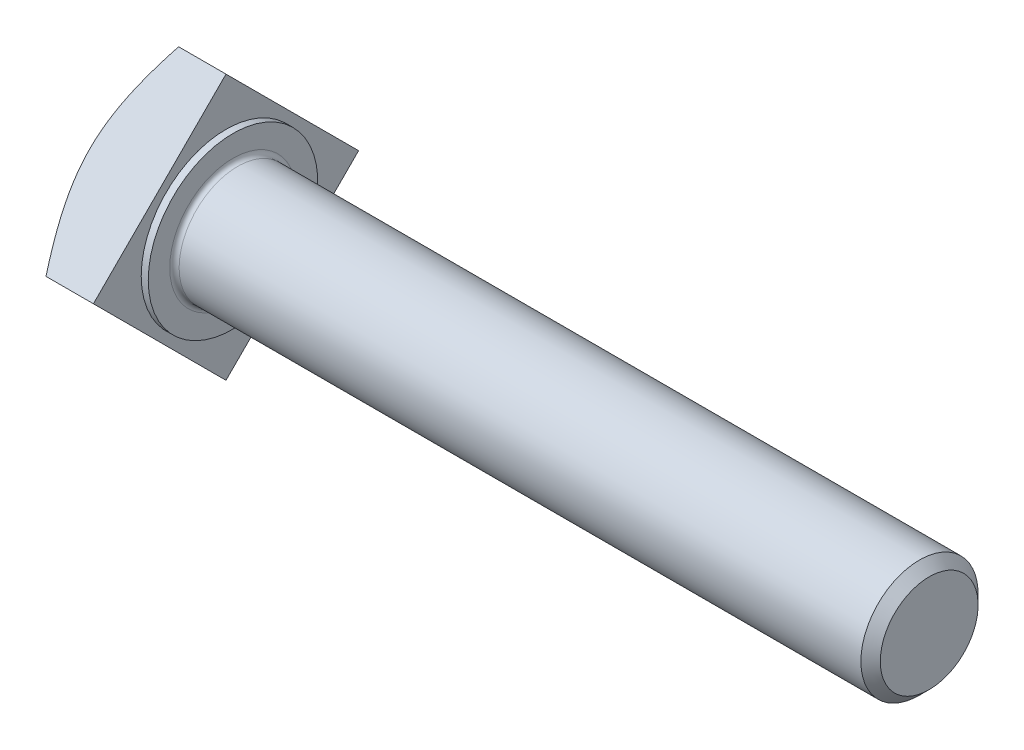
SolidWorks part; units mm, degrees
ref_plane "Front Plane" through (0, 0, 0) normal (0, 0, 1) x (1, 0, 0)
ref_plane "Top Plane" through (0, 0, 0) normal (0, 1, 0) x (1, 0, 0)
ref_plane "Right Plane" through (0, 0, 0) normal (1, 0, 0) x (0, 0, -1)
sketch "BaseHeadSke" plane through (0, 0, 0) normal (1, 0, 0) x (0, 0, -1)
  line L0 (-33.7114, 0) -> (29.9357, 0) construction
  line L1 (0, 35.0598) -> (0, -29.1266) construction
  line L2 (0, 11.3137) -> (11.3137, 0)
  line L3 (11.3137, 0) -> (0, -11.3137)
  line L4 (0, -11.3137) -> (-11.3137, 0)
  line L5 (-11.3137, 0) -> (0, 11.3137)
  dimension "Head_sidewidth" = 16
extrude "BaseHead" add sketch "BaseHeadSke" along normal blind 6.4
sketch "BodySke" plane through (0, 0, 0) normal (0, 0, 1) x (1, 0, 0)
  line L0 (0, 0) -> (81.8774, 0) construction
  line L1 (6.4, 0) -> (6.4, 7.235)
  line L2 (6.4, 11.3137) -> (6.4, 0) construction
  line L3 (6.4, 7.235) -> (7, 7.235)
  line L4 (7, 7.235) -> (7, 5)
  line L5 (7, 5) -> (65.572, 5)
  line L6 (65.572, 5) -> (66.4, 4.172)
  line L7 (66.4, 4.172) -> (66.4, 0)
  line L8 (66.4, 0) -> (6.4, 0)
  line L9 (7.9, 0) -> (7.9, 9.1784) construction
  line L10 (8.5, 0) -> (8.5, 9.1784) construction
  dimension "Bearing_dia" = 14.47
  dimension "Diameter" = 10
  dimension "Bearing_depth" = 0.6
  dimension "Length" = 60
  dimension "Thread_minor" = 8.344
  dimension "Body_Chamfer_angle" = 45
  dimension "Advance" = 1.5
  dimension "Distance" = 1.5
revolve "BaseBody" add sketch "BodySke" angle 360 about L0
fillet "Fillet1" radius 0.4 1 edges at (7, 0, 5)
sketch "HeadChamferSke" plane through (0, 0, 0) normal (0, 0, 1) x (1, 0, 0)
  line L0 (0, 0) -> (67.5964, 0) construction
  line L1 (0, 11.3137) -> (0, 7.235)
  line L2 (0, 7.235) -> (2.3548, 11.3137)
  line L3 (2.3548, 11.3137) -> (0, 11.3137)
  line L4 (6.4, 11.3137) -> (0, 11.3137) construction
  line L5 (0, 11.3137) -> (0, 0) construction
  dimension "Head_chamfer_angle" = 30
revolve "HeadChamfer" cut sketch "HeadChamferSke" angle 360 about L0
sketch "ThdSchSke" plane through (0, 0, 0) normal (0, 0, 1) x (1, 0, 0)
  line L0 (0, 0) -> (70.3562, 0) construction
  line L1 (0, 0) -> (81.8774, 0) construction
  line L2 (64.072, 5.9561) -> (64.072, 5)
  line L3 (64.072, 5.9561) -> (65.0281, 5.9561)
  line L4 (65.0281, 5.9561) -> (65.0281, 5)
  line L5 (65.0281, 5) -> (64.55, 4.172)
  line L6 (64.55, 4.172) -> (64.072, 5)
  dimension "D1" = 1.5
revolve "ThreadSchematic" [suppressed] cut sketch "ThdSchSke" angle 360 about L0
pattern_linear "ThdSchPat" [suppressed]
equation "\"D1@ThdSchSke\" = \"Advance@BodySke\""
equation "\"Tooth_Num@ThdSchPat\" =  int( (  \"Length@BodySke\" - \"Distance@BodySke\" - \"Bearing_depth@BodySke\" )  / \"Advance@BodySke\" ) "
equation "\"Advance@ThdSchPat\" = \"Advance@BodySke\""
equation "\"Thread_minor@ThreadCosmetic\" = \"Thread_minor@BodySke\""
